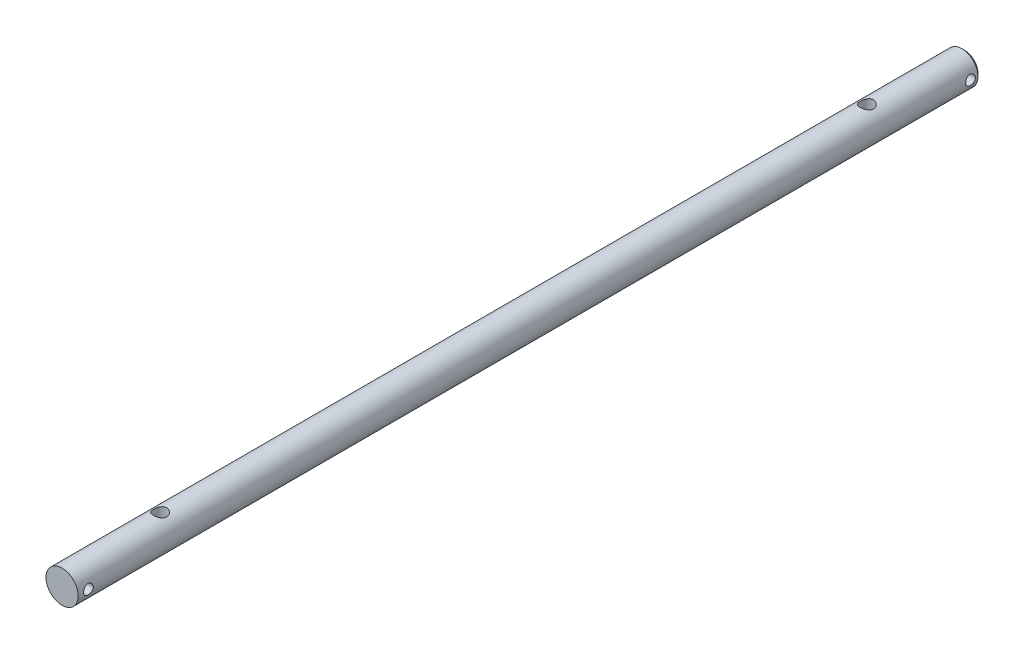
SolidWorks part; units mm, degrees
ref_plane "Plane1" through (0, 0, 0) normal (0, 0, 1) x (1, 0, 0)
ref_plane "Plane2" through (0, 0, 0) normal (0, 1, 0) x (1, 0, 0)
ref_plane "Plane3" through (0, 0, 0) normal (1, 0, 0) x (0, 0, -1)
sketch "Sketch1" plane through (0, 0, 0) normal (0, 0, 1) x (1, 0, 0)
  circle A0 centre (0, 0) radius 7.9375
  dimension "D1" = 15.875
extrude "rod" add sketch "Sketch1" along normal blind 444.5
sketch "Sketch2" plane through (0, 0, 0) normal (1, 0, 0) x (0, 0, -1)
  line L0 (-222.25, 7.9375) -> (-222.25, -56.4854) construction
  line L1 (0, -7.9375) -> (0, 7.9375) construction
  line L2 (0, 0) -> (-9.1652, 0) construction
  line L3 (-444.5, 0) -> (0, 0) construction
  line L4 (0, 7.9375) -> (-444.5, 7.9375) construction
  circle A0 centre (-5.08, 0.1505) radius 2.3812
  circle A1 centre (-439.42, 0.1505) radius 2.3813
  dimension "D2" = 4.7625
  dimension "D1" = 5.08
extrude "sprong retainer holes" cut sketch "Sketch2" against normal through all and the other way through all
sketch "Sketch3" plane through (0, 0, 0) normal (0, 1, 0) x (1, 0, 0)
  line L0 (-7.9375, -222.25) -> (76.8253, -222.25) construction
  line L1 (-7.9375, -7.4565) -> (-7.9375, -437.0435) construction
  line L2 (0, -444.5) -> (0, 0) construction
  line L3 (7.9375, 0) -> (-7.9375, 0) construction
  circle A0 centre (0, -48.26) radius 3.2639
  circle A1 centre (0, -396.24) radius 3.2639
  dimension "D1" = 6.5278
  dimension "D2" = 48.26
extrude "door holes" cut sketch "Sketch3" against normal through all and the other way through all
sketch "Sketch4" plane through (0, 0, 0) normal (0, 1, 0) x (1, 0, 0)
  line L0 (5.0853, 1.4339) -> (8.8043, -2.2851)
  line L1 (7.9375, 0) -> (-7.9375, 0) construction
  line L2 (5.0853, 1.4339) -> (8.8043, 1.4339)
  line L3 (8.8043, 1.4339) -> (12.3033, 1.4339)
  line L4 (8.8043, -458.5697) -> (13.634, -458.5697)
  line L6 (13.634, -458.5697) -> (13.634, 1.4339)
  line L7 (5.0853, -458.5697) -> (8.8043, -458.5697)
  line L8 (30.5851, -228.5679) -> (-72.5999, -228.5679) construction
  line L9 (5.0853, -458.5697) -> (8.8043, -454.8507)
  line L10 (8.8043, -2.2851) -> (8.8043, -454.8507)
  line L11 (12.3033, 1.4339) -> (13.634, 1.4339)
  line L12 (0, 0) -> (0, 13.6704) construction
  line L13 (0, -444.5) -> (0, 0) construction
  dimension "D1" = 45
revolve "Cut-Revolve1" cut sketch "Sketch4" angle 360 about L12
